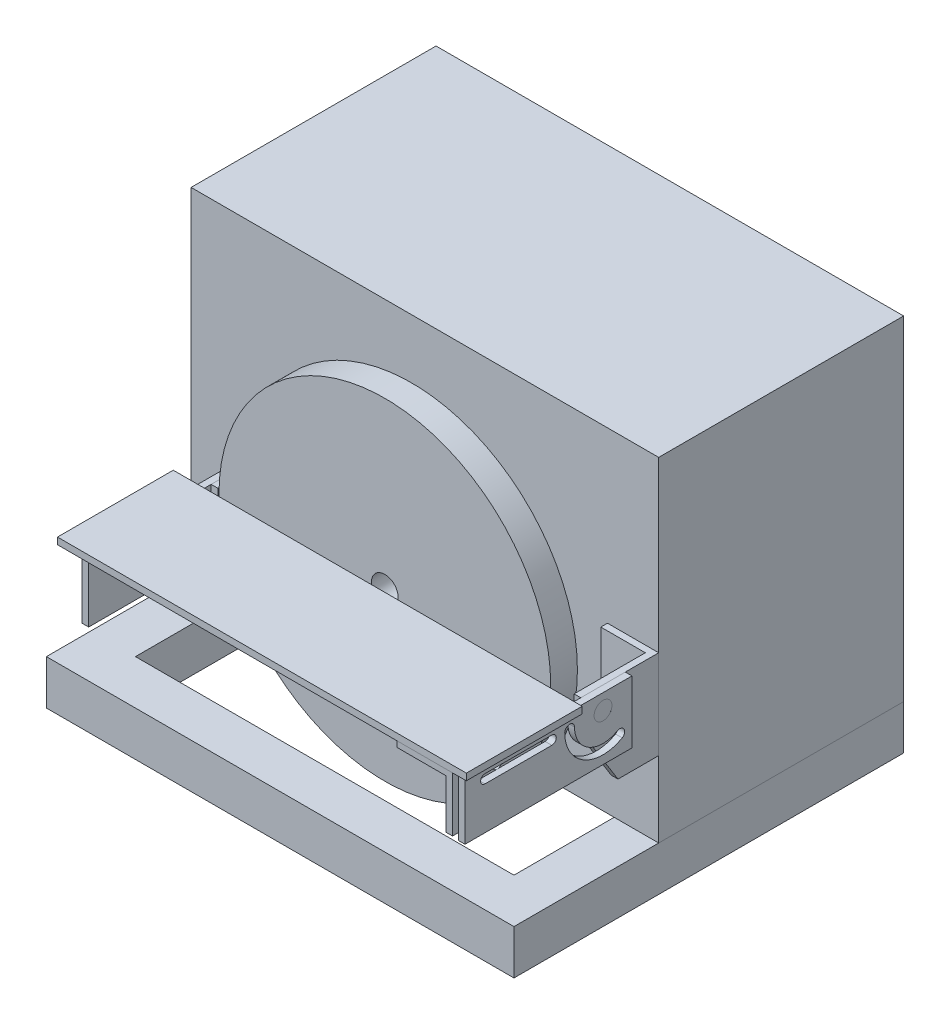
SolidWorks part; units mm, degrees
other "Tool Rest"
other "Plater"
other "Grinder Housing"
other "Base Frame"
other "Right Face Bracket"
other "Right Angle"
other "Right Slide"
other "Left Face Bracket"
other "Left Angle Plate"
ref_plane "Front Plane" through (0, 0, 0) normal (0, 0, 1) x (1, 0, 0)
ref_plane "Top Plane" through (0, 0, 0) normal (0, 1, 0) x (1, 0, 0)
ref_plane "Right Plane" through (0, 0, 0) normal (1, 0, 0) x (0, 0, -1)
sketch "Sketch1" plane through (0, 0, 0) normal (0, 1, 0) x (1, 0, 0)
  line L1 (-105, 87.5) -> (105, 87.5)
  line L2 (-105, 87.5) -> (-105, -87.5)
  line L3 (-105, -87.5) -> (105, -87.5)
  line L4 (105, 87.5) -> (105, -87.5)
  line L5 (-105, 87.5) -> (105, -87.5) construction
  line L6 (-105, -87.5) -> (105, 87.5) construction
  line L7 (85, 67.5) -> (85, -67.5)
  line L8 (-85, -67.5) -> (85, -67.5)
  line L9 (-85, 67.5) -> (-85, -67.5)
  line L10 (-85, 67.5) -> (85, 67.5) construction
  line L11 (-85, 67.5) -> (-85, 87.5)
  line L12 (85, 67.5) -> (85, 87.5)
  point P0 (0, 0)
  dimension "D1" = 210
  dimension "D2" = 175
  dimension "D3" = 20
extrude "Boss-Extrude1" add sketch "Sketch1" along normal blind 20 contours L12 L7 L8 L9 L11 L1 L2 L3 L4
sketch "Sketch2" plane through (0, 20, 0) normal (0, 1, 0) x (1, 0, 0)
  line L0 (105, 87.5) -> (105, -87.5) construction
  line L1 (-105, 87.5) -> (105, 87.5)
  line L2 (-105, 87.5) -> (-105, -22.5)
  line L3 (-105, -22.5) -> (105, -22.5)
  line L4 (105, 87.5) -> (105, -22.5)
  dimension "D1" = 110
extrude "Boss-Extrude2" add sketch "Sketch2" along normal blind 150 separate body
sketch "Sketch3" plane through (0, 0, 22.5) normal (0, 0, 1) x (1, 0, 0)
  line L0 (105, 170) -> (105, 20) construction
  line L1 (-105, 20) -> (105, 20) construction
  circle A0 centre (22, 97) radius 4
  dimension "D3" = 8
  dimension "D1" = 83
  dimension "D2" = 77
extrude "Boss-Extrude3" add sketch "Sketch3" along normal blind 28
sketch "Sketch4" plane through (0, 0, 50.5) normal (0, 0, 1) x (1, 0, 0)
  circle A0 centre (22, 97) radius 18.5
  dimension "D1" = 37
extrude "Boss-Extrude4" add sketch "Sketch4" against normal blind 5
sketch "Sketch5" plane through (0, 0, 50.5) normal (0, 0, 1) x (1, 0, 0)
  circle A0 centre (22, 97) radius 6
  dimension "D1" = 12
extrude "Boss-Extrude5" add sketch "Sketch5" along normal blind 2 contours A0
sketch "Sketch6" plane through (0, 0, 50.5) normal (0, 0, 1) x (1, 0, 0)
  circle A0 centre (22, 97) radius 74.5
  circle A1 centre (22, 97) radius 6 construction
  circle A2 centre (22, 97) radius 6
  dimension "D1" = 149
extrude "Boss-Extrude6" add sketch "Sketch6" along normal blind 12 separate body
ref_plane "Plane1" through (0, 97, 0) normal (0, -1, 0) x (-1, 0, 0)
sketch "Sketch7" plane through (0, 97, 0) normal (0, -1, 0) x (-1, 0, 0)
  line L0 (-96.5, -62.5) -> (52.5, -62.5) construction
  line L1 (-96.5, -62.5) -> (52.5, -62.5) construction
  line L2 (-96.5, -50.5) -> (-96.5, -62.5) construction
  line L3 (52.5, -62.5) -> (52.5, -50.5) construction
  line L4 (-96.5, -50.5) -> (-96.5, -62.5) construction
  line L5 (52.5, -62.5) -> (52.5, -50.5) construction
  line L6 (-97.5, -50.5) -> (-97.5, -63.5) construction
  line L7 (-97.5, -63.5) -> (53.5, -63.5)
  line L8 (53.5, -63.5) -> (53.5, -50.5) construction
  line L11 (-111.611, -63.5) -> (-111.611, -115.5)
  line L12 (-111.611, -115.5) -> (72.0156, -115.5)
  line L15 (72.0156, -63.5) -> (72.0156, -115.5)
  line L16 (-97.5, -63.5) -> (-111.611, -63.5)
  line L17 (53.5, -63.5) -> (72.0156, -63.5)
  dimension "D1" = 1
extrude "Boss-Extrude7" add sketch "Sketch7" along normal blind 3 separate body
ref_plane "Plane2" through (101.611, 0, 0) normal (1, 0, 0) x (0, 0, -1)
sketch "Sketch13" plane through (0, 0, 22.5) normal (0, 0, 1) x (1, 0, 0)
  line L0 (105, 170) -> (105, 20) construction
  line L1 (105, 94) -> (82, 94)
  line L2 (105, 94) -> (105, 54)
  line L3 (105, 54) -> (82, 54)
  line L4 (82, 94) -> (82, 54)
  circle A0 centre (22, 97) radius 4 construction
  circle A1 centre (22, 97) radius 4
  dimension "D1" = 23
  dimension "D2" = 40
  dimension "D3" = 3
extrude "Boss-Extrude12" add sketch "Sketch13" along normal blind 3 separate body
sketch "Sketch14" plane through (0, 0, 25.5) normal (0, 0, 1) x (1, 0, 0)
  line L0 (82, 54) -> (105, 54) construction
  line L1 (105, 94) -> (102, 94)
  line L2 (105, 94) -> (105, 54)
  line L3 (105, 54) -> (102, 54)
  line L4 (102, 94) -> (102, 54)
  dimension "D1" = 3
extrude "Boss-Extrude13" add sketch "Sketch14" along normal blind 32
sketch "Sketch15" plane through (105, 0, 0) normal (1, 0, 0) x (0, 0, -1)
  line L1 (-57.5, 94) -> (-22.5, 94) construction
  line L2 (-57.5, 54) -> (-57.5, 94) construction
  circle A0 centre (-50.5, 87) radius 4
  dimension "D1" = 8
  dimension "D2" = 7
  dimension "D3" = 7
extrude "Boss-Extrude14" add sketch "Sketch15" along normal blind 3
sketch "Sketch16" plane through (105, 0, 0) normal (1, 0, 0) x (0, 0, -1)
  line L0 (-50.5, 87) -> (-89.8867, 87) construction
  line L1 (-37.5, 66) -> (-112.5, 66)
  line L2 (-37.5, 66) -> (-37.5, 94)
  line L3 (-37.5, 94) -> (-112.5, 94)
  line L4 (-112.5, 66) -> (-112.5, 94)
  line L5 (-50.5, 87) -> (-36.3124, 62.4264) construction
  line L6 (-103.5, 87) -> (-73.5, 87) construction
  line L7 (-103.5, 88.996) -> (-73.5, 88.996)
  line L8 (-103.5, 85.004) -> (-73.5, 85.004)
  circle A0 centre (-50.5, 87) radius 4 construction
  circle A1 centre (-50.5, 87) radius 4
  arc A2 (-43, 74.0096) -> (-65.5, 87) centre (-50.5, 87) cw
  arc A3 (-44.1, 75.9149) -> (-63.3, 87) centre (-50.5, 87) cw
  arc A4 (-41.9, 72.1044) -> (-67.7, 87) centre (-50.5, 87) cw
  arc A5 (-44.1, 75.9149) -> (-41.9, 72.1044) centre (-43, 74.0096) cw
  arc A6 (-63.3, 87) -> (-67.7, 87) centre (-65.5, 87) ccw
  arc A7 (-103.5, 88.996) -> (-103.5, 85.004) centre (-103.5, 87) ccw
  arc A8 (-73.5, 85.004) -> (-73.5, 88.996) centre (-73.5, 87) ccw
  point P20 (-88.5, 87)
  dimension "D3" = 75
  dimension "D4" = 28
  dimension "D5" = 15
  dimension "D6" = 13
  dimension "D7" = 7
  dimension "D8" = 120
  dimension "D9" = 36
  dimension "D10" = 30
  dimension "D1" = 2.2
  dimension "D2" = 2.2
extrude "Boss-Extrude15" add sketch "Sketch16" along normal blind 3 separate body contours A6 A3 L2 L3 L4 L1 A4 M12 M11 | A3 A5 A4 L1 L2 M12 M11 M9
sketch "Sketch17" plane through (0, 94, 0) normal (0, -1, 0) x (1, 0, 0)
  line L0 (105, 37.5) -> (105, 112.5) construction
  line L1 (105, 37.5) -> (105, 112.5)
  line L3 (105, 75.0847) -> (80, 75.0847)
  line L4 (105, 75.0847) -> (105, 115.0847)
  line L5 (105, 115.0847) -> (80, 115.0847)
  line L6 (80, 75.0847) -> (80, 115.0847)
  dimension "D1" = 40
  dimension "D2" = 25
extrude "Boss-Extrude16" add sketch "Sketch17" along normal blind 3 separate body contours L6 L3 L1 L4 L5
sketch "Sketch18" plane through (0, 91, 0) normal (0, -1, 0) x (1, 0, 0)
  line L0 (105, 115.0847) -> (80, 115.0847) construction
  line L1 (105, 75.0847) -> (102, 75.0847)
  line L2 (105, 75.0847) -> (105, 115.0847)
  line L3 (105, 115.0847) -> (102, 115.0847)
  line L4 (102, 75.0847) -> (102, 115.0847)
  dimension "D1" = 3
extrude "Boss-Extrude17" add sketch "Sketch18" along normal blind 22
sketch "Sketch19" plane through (102, 0, 0) normal (-1, 0, 0) x (0, 0, 1)
  line L0 (115.0847, 91) -> (75.0847, 91) construction
  line L3 (75.0847, 69) -> (75.0847, 91) construction
  circle A2 centre (95.0847, 87) radius 2
  dimension "D1" = 4
  dimension "D2" = 4
  dimension "D3" = 20
extrude "Cut-Extrude1" cut sketch "Sketch19" against normal up to next (3 mm away)
sketch "Sketch21" plane through (0, 0, 22.5) normal (0, 0, 1) x (1, 0, 0)
  line L0 (82, 54) -> (105, 54) construction
  line L1 (-61, 94) -> (-38, 94)
  line L2 (-61, 94) -> (-61, 54)
  line L3 (-61, 54) -> (-38, 54)
  line L4 (-38, 94) -> (-38, 54)
  line L5 (82, 54) -> (105, 54)
  circle A0 centre (22, 97) radius 4 construction
  circle A1 centre (22, 97) radius 4
  dimension "D1" = 40
  dimension "D2" = 23
  dimension "D3" = 60
extrude "Boss-Extrude18" add sketch "Sketch21" along normal blind 3 separate body contours L4 L1 L2 L3
sketch "Sketch23" plane through (0, 0, 25.5) normal (0, 0, 1) x (1, 0, 0)
  line L0 (-61, 54) -> (-38, 54) construction
  line L1 (-61, 94) -> (-58, 94)
  line L2 (-61, 94) -> (-61, 54)
  line L3 (-61, 54) -> (-58, 54)
  line L4 (-58, 94) -> (-58, 54)
  dimension "D1" = 3
extrude "Boss-Extrude20" add sketch "Sketch23" along normal blind 32
sketch "Sketch25" plane through (-61, 0, 0) normal (-1, 0, 0) x (0, 0, 1)
  line L0 (57.5, 94) -> (22.5, 94) construction
  line L2 (57.5, 94) -> (57.5, 54) construction
  circle A0 centre (50.5, 87) radius 4
  dimension "D1" = 8
  dimension "D2" = 7
  dimension "D3" = 7
extrude "Boss-Extrude21" add sketch "Sketch25" along normal blind 3
sketch "Sketch26" plane through (-61, 0, 0) normal (-1, 0, 0) x (0, 0, 1)
  line L1 (37.5, 66) -> (112.5, 66)
  line L2 (37.5, 66) -> (37.5, 94)
  line L3 (37.5, 94) -> (112.5, 94)
  line L4 (112.5, 66) -> (112.5, 94)
  line L6 (50.5, 87) -> (71.6071, 87) construction
  line L7 (50.5, 87) -> (40.7418, 70.0984) construction
  circle A0 centre (50.5, 87) radius 4 construction
  circle A1 centre (50.5, 87) radius 4
  arc A2 (43, 74.0096) -> (65.5, 87) centre (50.5, 87) ccw
  arc A3 (41.9, 72.1044) -> (67.7, 87) centre (50.5, 87) ccw
  arc A4 (44.1, 75.9149) -> (63.3, 87) centre (50.5, 87) ccw
  arc A5 (41.9, 72.1044) -> (44.1, 75.9149) centre (43, 74.0096) cw
  arc A6 (67.7, 87) -> (63.3, 87) centre (65.5, 87) ccw
  dimension "D3" = 15
  dimension "D4" = 75
  dimension "D5" = 7
  dimension "D6" = 28
  dimension "D7" = 13
  dimension "D8" = 120
  dimension "D1" = 2.2
  dimension "D2" = 2.2
extrude "Boss-Extrude22" add sketch "Sketch26" along normal blind 3 separate body contours A3 A5 A4 L2 L1 M8 M9 M5 | A6 A3 L1 L4 L3 L2 A4 M8 M9
sketch "Sketch27" plane through (105, 0, 0) normal (1, 0, 0) x (0, 0, -1)
  line L0 (-57.5, 80.8006) -> (-40.781, 54)
  line L1 (-57.5, 54) -> (-57.5, 94) construction
  line L2 (-22.5, 54) -> (-22.5, 94) construction
  line L3 (-57.5, 54) -> (-22.5, 54) construction
  line L4 (-57.5, 94) -> (-22.5, 94) construction
  line L5 (-22.5, 54) -> (-22.5, 94)
  line L6 (-57.5, 54) -> (-22.5, 54)
  line L7 (-57.5, 94) -> (-22.5, 94)
  line L8 (-57.5, 54) -> (-57.5, 94)
extrude "Cut-Extrude3" cut sketch "Sketch27" against normal blind 3 contours L0 M4 M5
sketch "Sketch28" plane through (-58, 0, 0) normal (1, 0, 0) x (0, 0, -1)
  circle A0 centre (-50.5, 87) radius 4 construction
  circle A1 centre (-50.5, 87) radius 4
extrude "Boss-Extrude23" add sketch "Sketch28" along normal blind 3
sketch "Sketch29" plane through (102, 0, 0) normal (-1, 0, 0) x (0, 0, 1)
  circle A0 centre (50.5, 87) radius 4 construction
  circle A1 centre (50.5, 87) radius 4
extrude "Boss-Extrude24" add sketch "Sketch29" along normal blind 3
other "Save Bodies1"
